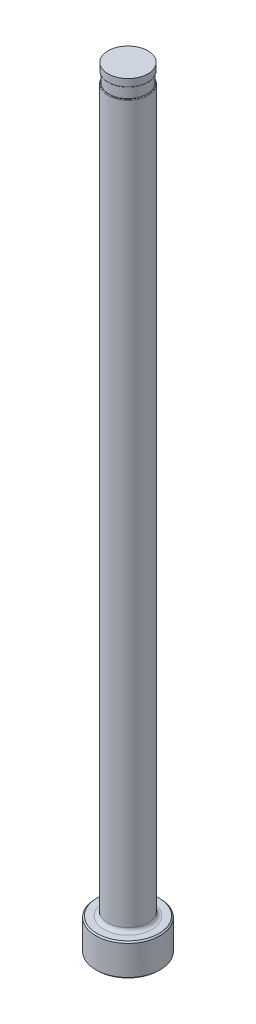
SolidWorks part; units mm, degrees
ref_plane "Front Plane" through (0, 0, 0) normal (0, 0, 1) x (1, 0, 0)
ref_plane "Top Plane" through (0, 0, 0) normal (0, 1, 0) x (1, 0, 0)
ref_plane "Right Plane" through (0, 0, 0) normal (1, 0, 0) x (0, 0, -1)
other "Configuration Table"
sketch "Sketch1" plane through (0, 0, 0) normal (0, 0, 1) x (1, 0, 0)
  line L0 (0, 259.9588) -> (0, -15.1925) construction
  line L1 (0, 0) -> (-6.35, 0)
  line L2 (-6.35, 0) -> (-6.35, 6.35)
  line L3 (-6.35, 6.35) -> (-3.9687, 6.35)
  line L4 (-3.9687, 6.35) -> (-3.9687, 152.4)
  line L5 (-3.9687, 152.4) -> (0, 152.4)
  line L6 (0, 152.4) -> (0, 0)
  dimension "L" = 152.4
  dimension "H" = 12.7
  dimension "T" = 6.35
  dimension "D" = 7.9375
revolve "Revolve1" add sketch "Sketch1" angle 360 about L0
chamfer "Chamfer1" distance 0.254 angle 45 2 edges at (0, 6.35, 6.35) (0, 0, 6.35)
fillet "Fillet1" radius 0.762 1 edges at (0, 6.35, 3.9687)
sketch "Sketch2" plane through (0, 0, 0) normal (0, 0, 1) x (1, 0, 0)
  line L0 (-3.9687, 152.4) -> (-3.9687, 7.112) construction
  line L1 (-3.9687, 150.876) -> (-3.7655, 150.876)
  line L2 (-3.9687, 150.876) -> (-3.9687, 148.844)
  line L3 (-3.9687, 148.844) -> (-3.7655, 148.844)
  line L4 (-3.7655, 150.876) -> (-3.7655, 148.844)
  line L5 (3.9687, 152.4) -> (-3.9687, 152.4) construction
  line L6 (0, 153.4483) -> (0, 147.3282) construction
  dimension "D1" = 2.032
  dimension "N" = 1.524
  dimension "FD" = 0.2032
  dimension "D3" = 7.5311
revolve "Vent Relief" cut sketch "Sketch2" angle 360 about L6
sketch "Sketch3" plane through (0, 0, 0) normal (0, 0, 1) x (1, 0, 0)
  line L0 (-3.7655, 149.86) -> (-3.7655, 86.36)
  line L1 (-3.7655, 150.876) -> (-3.7655, 148.844) construction
  line L2 (-3.9687, 148.844) -> (-3.9687, 7.112) construction
  line L3 (-3.9687, 85.2424) -> (-3.9687, 149.86)
  line L4 (-3.9687, 149.86) -> (-3.7655, 149.86)
  arc A0 (-3.7655, 86.36) -> (-3.9687, 85.2424) centre (-6.9405, 86.36) cw
  dimension "D1" = 3.175
  dimension "D2" = 63.5
extrude "D-Slot" cut sketch "Sketch3" against normal through all both and the other way through all
sketch "Sketch5" plane through (0, 0, 0) normal (0, 0, 1) x (1, 0, 0)
  line L0 (-3.9687, 150.876) -> (3.9687, 150.876) construction
  line L1 (-3.9687, 152.4) -> (-3.9433, 152.4)
  line L2 (-3.9687, 152.4) -> (-3.9687, 150.876)
  line L3 (-3.9687, 150.876) -> (-3.9433, 150.876)
  line L4 (-3.9433, 152.4) -> (-3.9433, 150.876)
  line L5 (0, 152.6877) -> (0, 150.5771) construction
  dimension "VP" = 0.0254
revolve "Vent Diameter" cut sketch "Sketch5" angle 360 about L5
fillet "Fillet2" radius 0.127 2 edges at (3.9687, 148.844, 0) (0, 150.876, 3.9433)
sketch "Pocket Sketch" plane through (0, 0, 0) normal (0, 0, 1) x (1, 0, 0)
  line L0 (-6.7469, 0) -> (-6.7469, 6.3754)
  line L1 (-6.7469, 6.3754) -> (-4.9292, 6.3754)
  line L2 (-4.1672, 7.1374) -> (-4.1672, 22.225)
  line L3 (-4.1672, 22.225) -> (0, 22.225)
  line L4 (0, 22.225) -> (0, 0)
  line L5 (0, 0) -> (-6.7469, 0)
  line L6 (0, 12.6104) -> (0, -2.4989) construction
  line L7 (-6.35, 6.096) -> (-6.35, 0.254) construction
  line L8 (6.096, 6.35) -> (-6.096, 6.35) construction
  line L9 (-3.9687, 85.2424) -> (-3.9687, 7.112) construction
  line L10 (-4.9292, 6.3754) -> (-4.1672, 7.1374)
  point P3 (-4.1672, 6.3754)
  dimension "D1" = 13.4937
  dimension "D2" = 0.3969
  dimension "D3" = 0.0254
  dimension "D4" = 0.1984
  dimension "D5" = 8.3344
  dimension "D6" = 22.225
